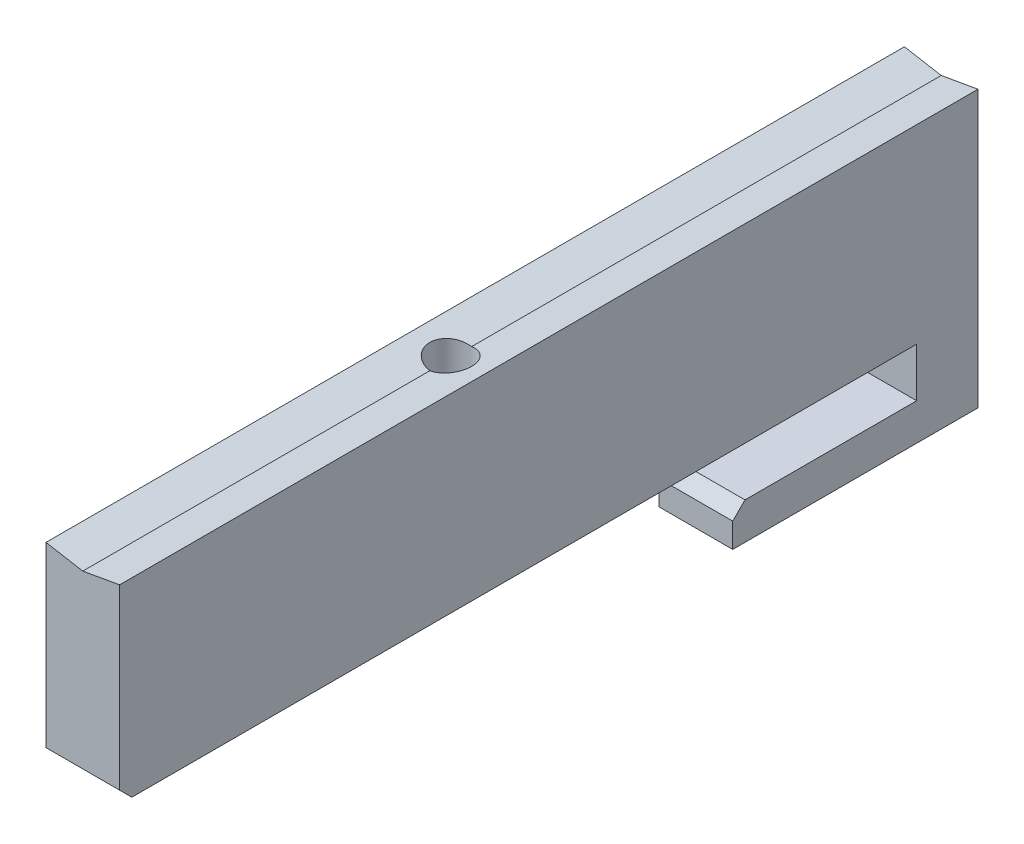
SolidWorks part; units mm, degrees
ref_plane "Plan de face" through (0, 0, 0) normal (0, 0, 1) x (1, 0, 0)
ref_plane "Plan de dessus" through (0, 0, 0) normal (0, 1, 0) x (1, 0, 0)
ref_plane "Plan de droite" through (0, 0, 0) normal (1, 0, 0) x (0, 0, -1)
sketch "Esquisse1" plane through (0, 0, 0) normal (0, 0, 1) x (1, 0, 0)
  line L1 (-6, -22.5) -> (6, -22.5)
  line L2 (-6, -22.5) -> (-6, 22.5)
  line L3 (-6, 22.5) -> (6, 22.5)
  line L4 (6, -22.5) -> (6, 22.5)
  line L5 (-6, -22.5) -> (6, 22.5) construction
  line L6 (-6, 22.5) -> (6, -22.5) construction
  point P0 (0, 0)
  dimension "D1" = 12
  dimension "D2" = 45
extrude "Boss.-Extru.1" add sketch "Esquisse1" along normal blind 140
sketch "Esquisse2" plane through (6, 0, 0) normal (1, 0, 0) x (0, 0, -1)
  line L1 (-140, -22.5) -> (-40, -22.5)
  line L2 (-140, -22.5) -> (-140, -8.5)
  line L3 (-140, -8.5) -> (-40, -8.5)
  line L4 (-40, -22.5) -> (-40, -8.5)
  line L5 (0, -22.5) -> (0, 22.5) construction
  dimension "D1" = 40
  dimension "D2" = 14
extrude "Enlèv. mat.-Extru.1" cut sketch "Esquisse2" against normal through all
sketch "Esquisse3" plane through (6, 0, 0) normal (1, 0, 0) x (0, 0, -1)
  line L0 (-40, -8.5) -> (-10, -8.5)
  line L1 (-10, -8.5) -> (-10, -16.5)
  line L2 (-10, -16.5) -> (-40, -16.5)
  line L3 (-40, -22.5) -> (-40, -8.5) construction
  line L4 (-40, -16.5) -> (-40, -8.5)
  dimension "D1" = 8
  dimension "D2" = 30
extrude "Enlèv. mat.-Extru.2" cut sketch "Esquisse3" against normal through all
chamfer "Chanfrein1" distance 2 angle 45 2 edges at (0, -16.5, 40) (0, -8.5, 140)
sketch "Esquisse4" plane through (0, 22.5, 0) normal (0, 1, 0) x (1, 0, 0)
  line L0 (6, -140) -> (-6, -140) construction
  line L1 (0, -140) -> (0, -80) construction
  circle A0 centre (0, -80) radius 2.6
  dimension "D1" = 60
  dimension "D2" = 5.2
extrude "Enlèv. mat.-Extru.3" cut sketch "Esquisse4" against normal through all
hole_wizard "Trou taraudé M8x1.251" positions "Esquisse6" profile "Esquisse5" tap size "M8x1.25" standard "Ansi Metric"
sketch "Esquisse6" plane through (0, 22.5, 0) normal (0, 1, 0) x (-1, 0, 0)
  point P1 (0, 80)
sketch "Esquisse5" plane through (0, 22.5, 80) normal (1, 0, 0) x (0, 0, 1)
  line L0 (0, 0) -> (0, 45)
  line L1 (0, 45) -> (3.4, 45)
  line L2 (3.4, 45) -> (3.4, 0)
  line L5 (3.4, 0) -> (0, 0)
  line L11 (0, -6.35) -> (0, 107.95) construction
  dimension "Diamètre du trou pour taraudage jusqu'au prochain" = 6.8
  dimension "Profondeur du trou pour taraudage jusqu'au prochain" = 45
sketch "Esquisse11" plane through (0, 0, 0) normal (0, 0, -1) x (-1, 0, 0)
  line L5 (0, 21.442) -> (-6, 22.5)
  line L6 (-6, 22.5) -> (6, 22.5)
  line L7 (6, 22.5) -> (0, 21.442)
  line L8 (0, 21.442) -> (0, 0) construction
  dimension "D1" = 10
  dimension "D2" = 10
extrude "Enlèv. mat.-Extru.4" cut sketch "Esquisse11" against normal through all
sketch "Esquisse10" plane through (0, 0, 0) normal (0, 0, -1) x (-1, 0, 0)
  line L0 (0, 56.982) -> (0, 0) construction
  line L2 (-6, 22.5) -> (0, 21.442) construction
  circle A0 centre (0, 56.982) radius 35
  circle A1 centre (0, 46.8277) radius 25
  circle A2 centre (0, 36.6734) radius 15
  circle A3 centre (0, 31.5963) radius 10
  dimension "D1" = 70
  dimension "D2" = 50
  dimension "D3" = 30
  dimension "D4" = 20
